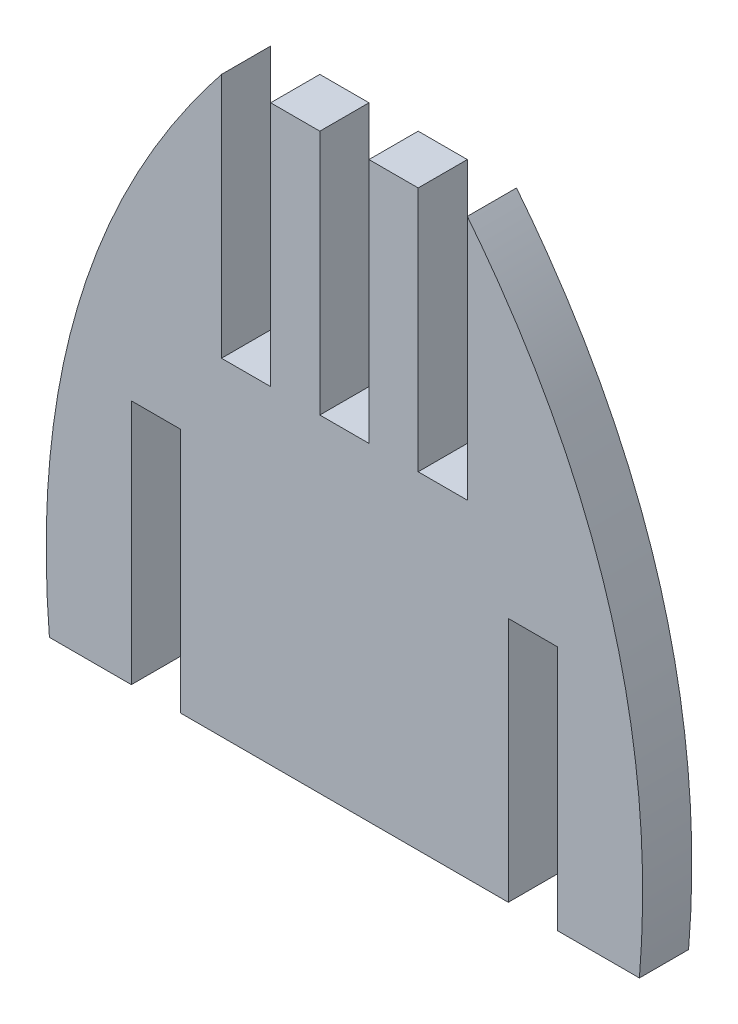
SolidWorks part; units mm, degrees
ref_plane "Alzado" through (0, 0, 0) normal (0, 0, 1) x (1, 0, 0)
ref_plane "Planta" through (0, 0, 0) normal (0, 1, 0) x (1, 0, 0)
ref_plane "Vista lateral" through (0, 0, 0) normal (1, 0, 0) x (0, 0, -1)
sketch "Croquis1" plane through (0, 0, 0) normal (0, 0, 1) x (1, 0, 0)
  line L0 (-15.8981, -0.828) -> (-10.8981, -0.828)
  line L1 (-5.3981, 34.172) -> (-5.3981, 19.172)
  line L2 (-5.3981, 19.172) -> (-2.3981, 19.172)
  line L4 (-2.3981, 19.172) -> (-2.3981, 34.172)
  line L5 (0.6019, 19.172) -> (0.6019, 34.172)
  line L6 (-2.3981, 34.172) -> (0.6019, 34.172)
  line L7 (0.6019, 19.172) -> (3.6019, 19.172)
  line L8 (2.1019, -45.9221) -> (2.1019, 152.1115) construction
  line L11 (-7.8981, -0.828) -> (-7.8981, 14.172)
  line L12 (-7.8981, 14.172) -> (-10.8981, 14.172)
  line L13 (-10.8981, -0.828) -> (-10.8981, 14.172)
  line L14 (12.1019, 14.172) -> (15.1019, 14.172)
  line L15 (15.1019, -0.828) -> (15.1019, 14.172)
  line L17 (12.1019, -0.828) -> (12.1019, 14.172)
  line L18 (-7.8981, -0.828) -> (12.1019, -0.828)
  line L19 (15.1019, -0.828) -> (20.1019, -0.828)
  line L20 (3.6019, 19.172) -> (3.6019, 34.172)
  line L21 (3.6019, 34.172) -> (6.6019, 34.172)
  line L22 (6.6019, 34.172) -> (6.6019, 19.172)
  line L23 (6.6019, 19.172) -> (9.6019, 19.172)
  line L24 (9.6019, 19.172) -> (9.6019, 34.172)
  spline S0 degree 2 poles (-15.8981, -0.828) (-17.5494, 18.8632) (-5.3981, 34.172) knots 0 0 0 1 1 1
  spline S1 degree 2 poles (20.1019, -0.828) (21.7532, 18.8632) (9.6019, 34.172) knots 0 0 0 1 1 1
  dimension "D3" = 3
  dimension "D1" = 3
  dimension "D2" = 3
  dimension "D4" = 15
  dimension "D5" = 3
  dimension "D6" = 15
  dimension "D7" = 15
  dimension "D8" = 3
  dimension "D9" = 3
  dimension "D10" = 20
extrude "Saliente-Extruir1" add sketch "Croquis1" along normal blind 3 contours S1 L24 L23 L22 L21 L20 L7 L5 L6 L4 L2 L1 S0 L0 L13 L12 L11 L18 L17 L14 L15 L19
